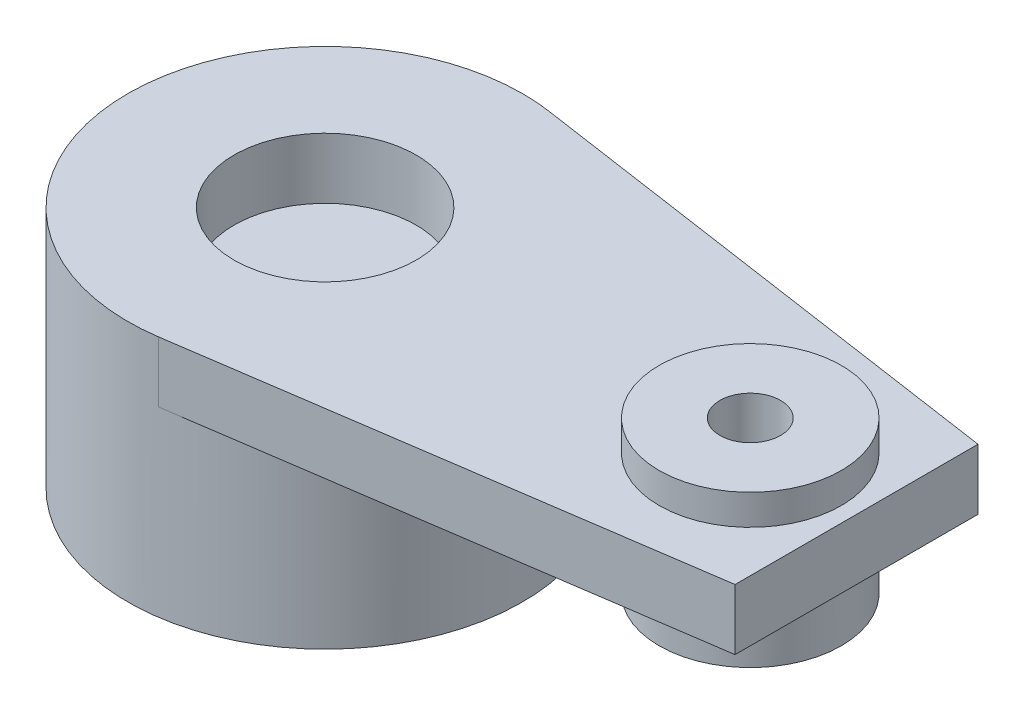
SolidWorks part; units mm, degrees
ref_plane "Front Plane" through (0, 0, 0) normal (0, 0, 1) x (1, 0, 0)
ref_plane "Top Plane" through (0, 0, 0) normal (0, 1, 0) x (1, 0, 0)
ref_plane "Right Plane" through (0, 0, 0) normal (1, 0, 0) x (0, 0, -1)
sketch "Sketch1" plane through (0, 0, 0) normal (0, 1, 0) x (1, 0, 0)
  line L0 (0, 0) -> (22.225, 0) construction
  line L1 (22.225, 5.08) -> (1.1993, 8.1674)
  line L2 (0, 5.08) -> (22.225, 5.08)
  line L3 (0, 5.08) -> (0, -5.08)
  line L4 (0, -5.08) -> (22.225, -5.08)
  line L5 (22.225, 5.08) -> (22.225, -5.08)
  line L6 (0, 5.08) -> (22.225, -5.08) construction
  line L7 (0, -5.08) -> (22.225, 5.08) construction
  line L8 (22.225, -5.08) -> (1.1993, -8.1674)
  line L10 (8.255, 8.255) -> (-8.255, 8.255) construction
  line L11 (8.255, 8.255) -> (8.255, -8.255) construction
  line L12 (8.255, -8.255) -> (-8.255, -8.255) construction
  line L13 (-8.255, 8.255) -> (-8.255, -8.255) construction
  line L14 (8.255, 8.255) -> (-8.255, -8.255) construction
  line L15 (8.255, -8.255) -> (-8.255, 8.255) construction
  circle A0 centre (0, 0) radius 8.255
  point P3 (11.1125, 0)
other "AlignGroup1" parameters "D2"=13.993, "D1"=16.51, "D3"=9.8197, "D4"=16.51
extrude "Boss-Extrude1" add sketch "Sketch1" along normal blind 2.54 contours L4 A0 L2 L3 | A0 L4 L3 L2 | A0 L4 L5 L2 | A0 L8 L4 | A0 L2 L1
sketch "Sketch2" plane through (0, 2.54, 0) normal (0, 1, 0) x (1, 0, 0)
  circle A0 centre (0, 0) radius 3.81
  circle A1 centre (17.78, 0) radius 1.27
  dimension "D1" = 7.62
  dimension "D3" = 2.54
  dimension "D2" = 17.78
  dimension "D4" = 5.08
extrude "Cut-Extrude1" cut sketch "Sketch2" against normal through all
sketch "Sketch3" plane through (0, 0, 0) normal (0, -1, 0) x (1, 0, 0)
  circle A0 centre (0, 0) radius 8.255
extrude "Boss-Extrude2" add sketch "Sketch3" along normal blind 7.62
sketch "Sketch4" plane through (0, 0, 0) normal (0, -1, 0) x (1, 0, 0)
  circle A0 centre (17.78, 0) radius 3.81
  circle A1 centre (17.78, 0) radius 1.27
  dimension "D1" = 7.62
extrude "Boss-Extrude3" add sketch "Sketch4" along normal blind 2.54
sketch "Sketch5" plane through (0, 2.54, 0) normal (0, 1, 0) x (1, 0, 0)
  circle A0 centre (17.78, 0) radius 3.81
  circle A1 centre (17.78, 0) radius 1.27
  dimension "D1" = 7.62
extrude "Boss-Extrude4" add sketch "Sketch5" along normal blind 1.27
sketch "Sketch6" plane through (0, -7.62, 0) normal (0, -1, 0) x (1, 0, 0)
  circle A0 centre (0, 0) radius 2.54
  dimension "D1" = 5.08
extrude "Cut-Extrude2" cut sketch "Sketch6" against normal blind 2.54
